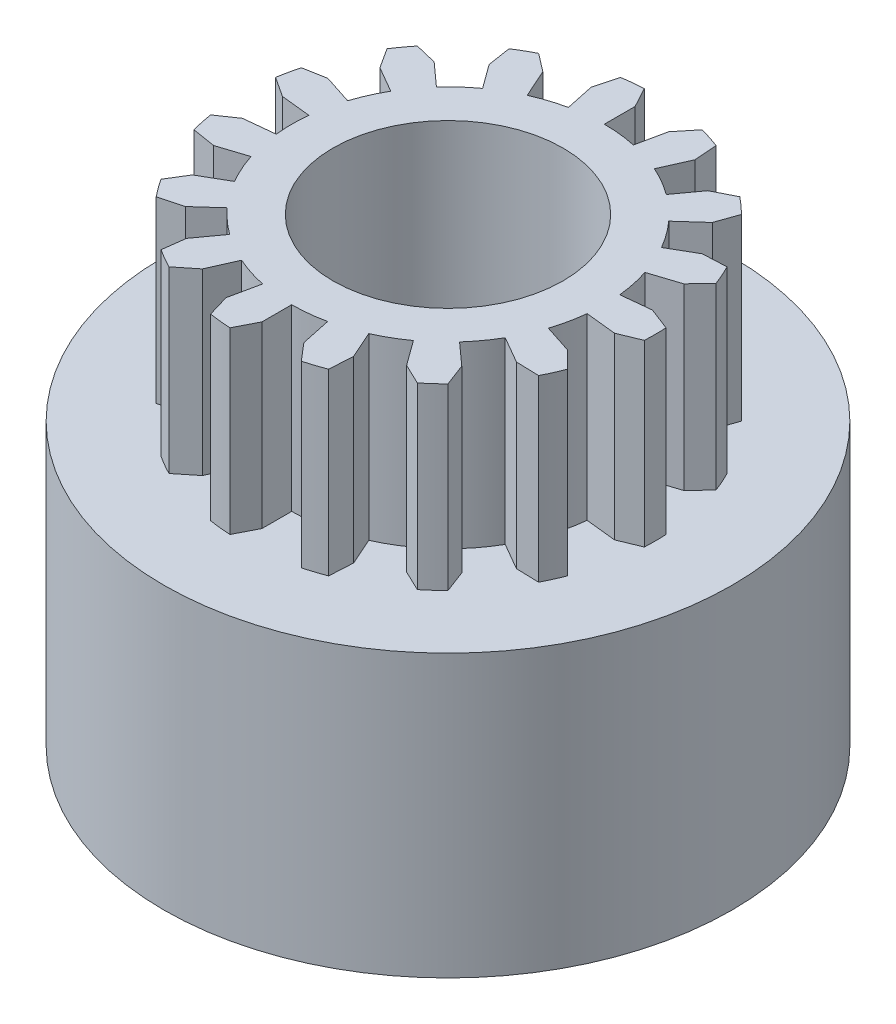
SolidWorks part; units mm, degrees
ref_plane "Front Plane" through (0, 0, 0) normal (0, 0, 1) x (1, 0, 0)
ref_plane "Top Plane" through (0, 0, 0) normal (0, 1, 0) x (1, 0, 0)
ref_plane "Right Plane" through (0, 0, 0) normal (1, 0, 0) x (0, 0, -1)
sketch "Sketch1" plane through (0, 0, 0) normal (0, 0, 1) x (1, 0, 0)
  line L0 (11.1125, 11) -> (0, 11)
  line L1 (0, 11) -> (0, 0)
  line L2 (0, 0) -> (11.1125, 0)
  line L3 (11.1125, 0) -> (11.1125, 11)
  line L4 (0, 11) -> (0, 0) construction
revolve "Revolve1" add sketch "Sketch1" angle 360 about L4
sketch "Sketch2" plane through (0, 11, 0) normal (0, 1, 0) x (-1, 0, 0)
  line L0 (-7.2771, 0.7649) -> (-6.079, 0.6389)
  line L1 (-5.8133, 1.8889) -> (-6.918, 2.2478)
  line L2 (-6.918, 2.2478) -> (-7.5737, 2.9073)
  line L3 (-7.2283, 3.683) -> (-6.3369, 3.6586)
  line L4 (-6.3369, 3.6586) -> (-5.2936, 3.0562)
  line L5 (-4.5425, 4.0901) -> (-5.4057, 4.8673)
  line L6 (-5.4057, 4.8673) -> (-5.7364, 5.7364)
  line L7 (-5.1054, 6.3046) -> (-4.301, 5.9198)
  line L8 (-4.301, 5.9198) -> (-3.5928, 4.9451)
  line L9 (-2.4862, 5.584) -> (-2.9586, 6.6452)
  line L10 (-2.9586, 6.6452) -> (-2.9073, 7.5737)
  line L11 (-2.0997, 7.8361) -> (-1.5213, 7.1573)
  line L12 (-1.5213, 7.1573) -> (-1.2709, 5.9789)
  line L13 (0, 6.1125) -> (0, 7.2741)
  line L14 (0, 7.2741) -> (0.4246, 8.1014)
  line L15 (1.2691, 8.0126) -> (1.5213, 7.1573)
  line L16 (1.5213, 7.1573) -> (1.2709, 5.9789)
  line L17 (2.4862, 5.584) -> (2.9586, 6.6452)
  line L18 (2.9586, 6.6452) -> (3.683, 7.2283)
  line L19 (4.4184, 6.8037) -> (4.301, 5.9198)
  line L20 (4.301, 5.9198) -> (3.5928, 4.9451)
  line L21 (4.5425, 4.0901) -> (5.4057, 4.8673)
  line L22 (5.4057, 4.8673) -> (6.3046, 5.1054)
  line L23 (6.8037, 4.4184) -> (6.3369, 3.6586)
  line L24 (6.3369, 3.6586) -> (5.2936, 3.0562)
  line L25 (5.8133, 1.8889) -> (6.918, 2.2478)
  line L26 (6.918, 2.2478) -> (7.8361, 2.0997)
  line L27 (8.0126, 1.2691) -> (7.2771, 0.7649)
  line L28 (7.2771, 0.7649) -> (6.079, 0.6389)
  line L29 (6.079, -0.6389) -> (7.2342, -0.7603)
  line L30 (7.2342, -0.7603) -> (8.0126, -1.2691)
  line L31 (7.8361, -2.0997) -> (6.9591, -2.2611)
  line L32 (6.9591, -2.2611) -> (5.8133, -1.8889)
  line L33 (5.2936, -3.0563) -> (6.2995, -3.637)
  line L34 (6.2995, -3.637) -> (6.8037, -4.4184)
  line L35 (6.3046, -5.1054) -> (5.4378, -4.8962)
  line L36 (5.4378, -4.8962) -> (4.5425, -4.0901)
  line L37 (3.5928, -4.9451) -> (4.2756, -5.8848)
  line L38 (4.2756, -5.8848) -> (4.4184, -6.8037)
  line L39 (3.683, -7.2283) -> (2.9762, -6.6846)
  line L40 (2.9762, -6.6846) -> (2.4862, -5.584)
  line L41 (1.2709, -5.9789) -> (1.5124, -7.1151)
  line L42 (1.5124, -7.1151) -> (1.2691, -8.0126)
  line L43 (0.4246, -8.1014) -> (0, -7.3172)
  line L44 (0, -7.3172) -> (0, -6.1125)
  line L45 (-1.2709, -5.9789) -> (-1.5124, -7.1151)
  line L46 (-1.5124, -7.1151) -> (-2.0997, -7.8361)
  line L47 (-2.9073, -7.5737) -> (-2.9762, -6.6846)
  line L48 (-2.9762, -6.6846) -> (-2.4862, -5.584)
  line L49 (-3.5928, -4.9451) -> (-4.2756, -5.8848)
  line L50 (-4.2756, -5.8848) -> (-5.1054, -6.3046)
  line L51 (-5.7364, -5.7364) -> (-5.4378, -4.8962)
  line L52 (-5.4378, -4.8962) -> (-4.5425, -4.0901)
  line L53 (-5.2936, -3.0562) -> (-6.2995, -3.637)
  line L54 (-6.2995, -3.637) -> (-7.2283, -3.683)
  line L55 (-7.5737, -2.9073) -> (-6.9591, -2.2611)
  line L56 (-6.9591, -2.2611) -> (-5.8133, -1.8889)
  line L57 (-6.079, -0.6389) -> (-7.2342, -0.7603)
  line L58 (-7.2342, -0.7603) -> (-8.1014, -0.4246)
  line L59 (-8.1014, 0.4246) -> (-7.2771, 0.7649)
  arc A0 (-6.079, 0.6389) -> (-5.8133, 1.8889) centre (0, 0) cw
  arc A1 (-7.5737, 2.9073) -> (-7.2283, 3.683) centre (0, 0) cw
  arc A2 (-5.2936, 3.0562) -> (-4.5425, 4.0901) centre (0, 0) cw
  arc A3 (-5.7364, 5.7364) -> (-5.1054, 6.3046) centre (0, 0) cw
  arc A4 (-3.5928, 4.9451) -> (-2.4862, 5.584) centre (0, 0) cw
  arc A5 (-2.9073, 7.5737) -> (-2.0997, 7.8361) centre (0, 0) cw
  arc A6 (-1.2709, 5.9789) -> (0, 6.1125) centre (0, 0) cw
  arc A7 (0.4246, 8.1014) -> (1.2691, 8.0126) centre (0, 0) cw
  arc A8 (1.2709, 5.9789) -> (2.4862, 5.584) centre (0, 0) cw
  arc A9 (3.683, 7.2283) -> (4.4184, 6.8037) centre (0, 0) cw
  arc A10 (3.5928, 4.9451) -> (4.5425, 4.0901) centre (0, 0) cw
  arc A11 (6.3046, 5.1054) -> (6.8037, 4.4184) centre (0, 0) cw
  arc A12 (5.2936, 3.0562) -> (5.8133, 1.8889) centre (0, 0) cw
  arc A13 (7.8361, 2.0997) -> (8.0126, 1.2691) centre (0, 0) cw
  arc A14 (6.079, 0.6389) -> (6.079, -0.6389) centre (0, 0) cw
  arc A15 (8.0126, -1.2691) -> (7.8361, -2.0997) centre (0, 0) cw
  arc A16 (5.8133, -1.8889) -> (5.2936, -3.0563) centre (0, 0) cw
  arc A17 (6.8037, -4.4184) -> (6.3046, -5.1054) centre (0, 0) cw
  arc A18 (4.5425, -4.0901) -> (3.5928, -4.9451) centre (0, 0) cw
  arc A19 (4.4184, -6.8037) -> (3.683, -7.2283) centre (0, 0) cw
  arc A20 (2.4862, -5.584) -> (1.2709, -5.9789) centre (0, 0) cw
  arc A21 (1.2691, -8.0126) -> (0.4246, -8.1014) centre (0, 0) cw
  arc A22 (0, -6.1125) -> (-1.2709, -5.9789) centre (0, 0) cw
  arc A23 (-2.0997, -7.8361) -> (-2.9073, -7.5737) centre (0, 0) cw
  arc A24 (-2.4862, -5.584) -> (-3.5928, -4.9451) centre (0, 0) cw
  arc A25 (-5.1054, -6.3046) -> (-5.7364, -5.7364) centre (0, 0) cw
  arc A26 (-4.5425, -4.0901) -> (-5.2936, -3.0562) centre (0, 0) cw
  arc A27 (-7.2283, -3.683) -> (-7.5737, -2.9073) centre (0, 0) cw
  arc A28 (-5.8133, -1.8889) -> (-6.079, -0.6389) centre (0, 0) cw
  arc A29 (-8.1014, -0.4246) -> (-8.1014, 0.4246) centre (0, 0) cw
extrude "Boss-Extrude1" add sketch "Sketch2" along normal blind 7
hole_wizard "Hole1" positions "Sketch4" profile "Sketch3" legacy
sketch "Sketch4" plane through (0, 0, 0) normal (0, -1, 0) x (1, 0, 0)
  point P0 (0, 0)
sketch "Sketch3" plane through (0, 0, 0) normal (1, 0, 0) x (0, 0, -1)
  line L0 (0, 0) -> (0, 18)
  line L1 (0, 18) -> (4.5, 18)
  line L2 (4.5, 18) -> (4.5, 3)
  line L3 (4.5, 3) -> (6.5, 3)
  line L4 (6.5, 3) -> (6.5, 0)
  line L5 (6.5, 0) -> (0, 0)
  line L6 (0, 110) -> (0, -10) construction
  dimension "Diameter" = 9
  dimension "Depth" = 18
  dimension "C-Bore Diameter" = 13
  dimension "C-Bore Depth" = 3
